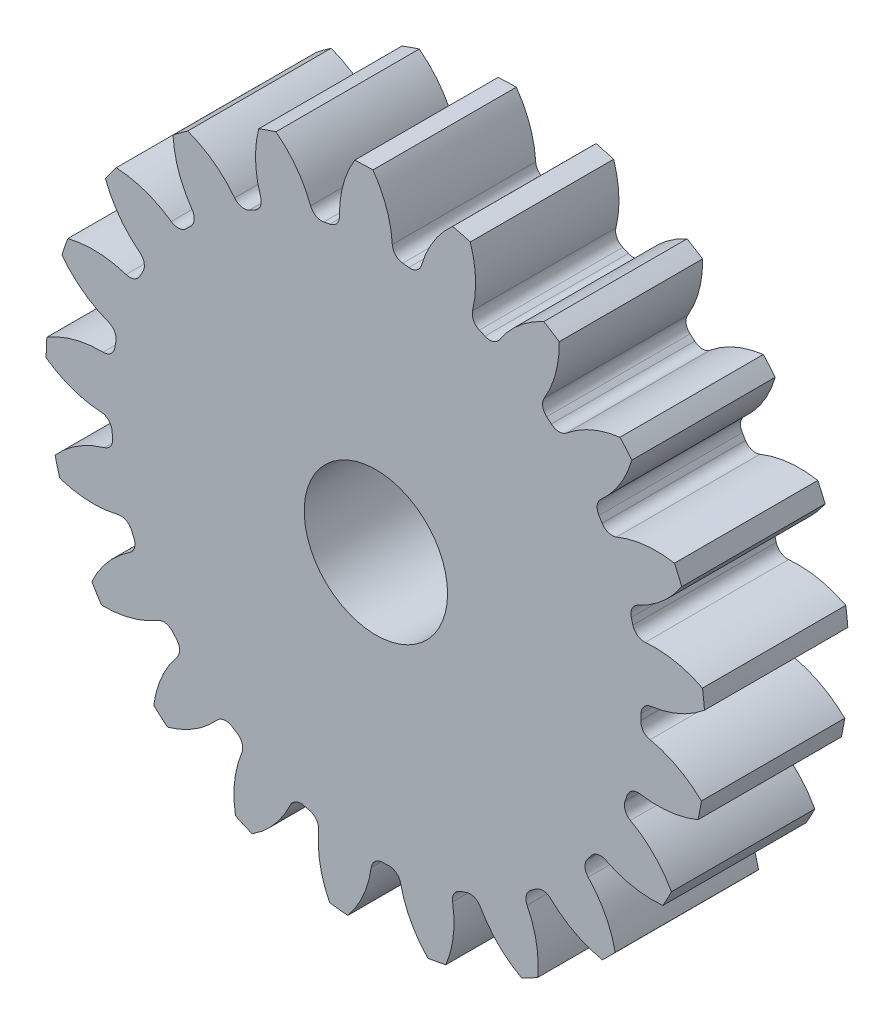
SolidWorks part; units mm, degrees
ref_plane "Front" through (0, 0, 0) normal (0, 0, 1) x (1, 0, 0)
ref_plane "Top" through (0, 0, 0) normal (0, 1, 0) x (1, 0, 0)
ref_plane "Right" through (0, 0, 0) normal (1, 0, 0) x (0, 0, -1)
sketch "Sketch3" plane through (0, 0, 0) normal (0, 0, 1) x (1, 0, 0)
  circle A0 centre (0, 0) radius 233.68
  dimension "od" = 467.36
extrude "gearBody" add sketch "Sketch3" along normal blind 101.6
sketch "Sketch2" plane through (0, 0, 0) normal (0, 0, 1) x (1, 0, 0)
  line L0 (0, 0) -> (185.2312, 76.7253) construction
  line L1 (231.45, -38.026) -> (0, 0) construction
  line L2 (0, 0) -> (36.3143, 0) construction
  line L3 (213.2191, 7.7533) -> (212.002, -24.0341) construction
  line L5 (212.6105, -8.1404) -> (0, 0) construction
  line L7 (0, 0) -> (200.4928, 0) construction
  arc A0 (200.4556, 3.8647) -> (199.5732, -19.1809) centre (0, 0) ccw construction
  arc A1 (232.8627, 19.5266) -> (230.6879, -37.275) centre (0, 0) ccw construction
  arc A2 (213.2191, 7.7533) -> (212.002, -24.0341) centre (0, 0) ccw construction
  arc A3 (187.7273, -9.3492) -> (187.8926, -5.0325) centre (0, 0) ccw
  arc A4 (231.45, -38.026) -> (194.2709, -17.8507) centre (178.8222, -90.6641) ccw
  arc A5 (231.45, -38.026) -> (233.68, 20.2172) centre (0, 0) ccw
  arc A6 (233.68, 20.2172) -> (195.0671, 2.9438) centre (185.2312, 76.7253) cw
  arc A7 (187.8926, -5.0325) -> (195.0671, 2.9438) centre (196.1599, -5.2539) cw
  arc A8 (194.2709, -17.8507) -> (187.7273, -9.3492) centre (195.9873, -9.7606) cw
  point P6 (233.68, 20.2172)
  point P22 (231.45, -38.026)
  dimension "baseDia" = 400.9856
  dimension "od" = 467.36
  dimension "pd" = 426.72
  dimension "rd" = 375.92
  dimension "rFillet" = 8.2702
  dimension "pointX" = 233.68
  dimension "pointY" = 20.2172
  dimension "CTT" = 31.7875
  dimension "flankCenterAngle" = 22.5
extrude "toothCut" cut sketch "Sketch2" along normal through all
pattern_circular "CirPattern1" count 21 over 360 about axis through (0, 0, 0) along (0, 0, 1) of "toothCut"
sketch "hub1Dia" plane through (0, 0, 0) normal (0, 0, -1) x (-1, 0, 0)
  circle A0 centre (0, 0) radius 12.7
  dimension "hub1Dia" = 25.4
sketch "hub2Dia" plane through (0, 0, 101.6) normal (0, 0, 1) x (1, 0, 0)
  circle A0 centre (0, 0) radius 12.7
  dimension "hub2dia" = 25.4
sketch "boreDia" plane through (0, 0, 0) normal (0, 0, 1) x (1, 0, 0)
  circle A0 centre (0, 0) radius 50.8
  dimension "boreDia" = 101.6
extrude "bore" cut sketch "boreDia" against normal mid plane 25400
